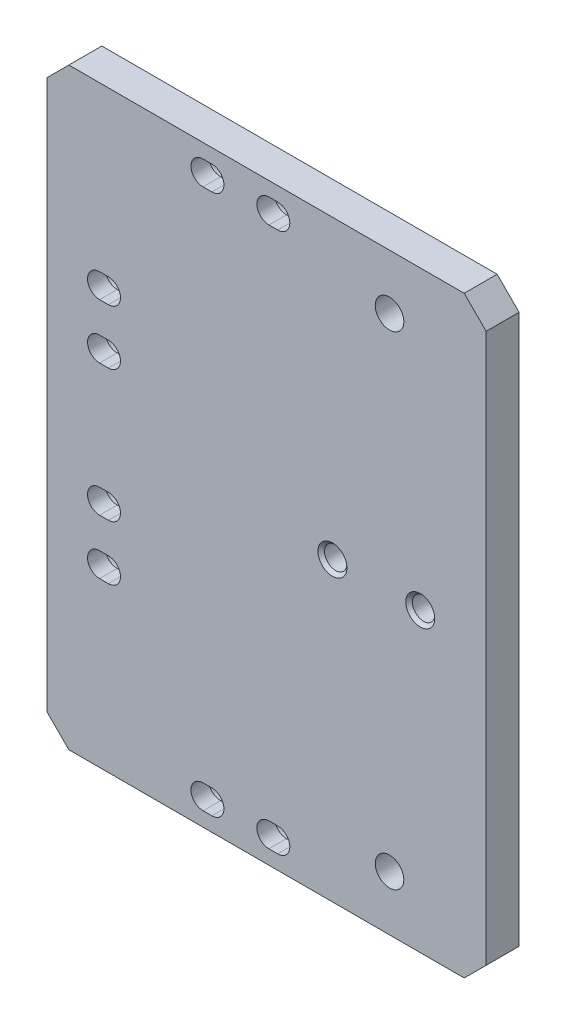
SolidWorks part; units mm, degrees
ref_plane "Plan1" through (0, 0, 0) normal (0, 0, 1) x (1, 0, 0)
ref_plane "Plan2" through (0, 0, 0) normal (0, 1, 0) x (1, 0, 0)
ref_plane "Plan3" through (0, 0, 0) normal (1, 0, 0) x (0, 0, -1)
sketch "Esquisse1" plane through (0, 0, 0) normal (0, 0, 1) x (1, 0, 0)
  line L0 (0, 0) -> (190, 0)
  line L1 (190, 0) -> (200, 10)
  line L2 (200, 260) -> (200, 10)
  line L3 (187.5, 365) -> (187.5, 15) construction
  line L4 (190, 270) -> (0, 270)
  line L5 (0, 270) -> (0, 0)
  line L6 (190, 270) -> (200, 260)
  circle A0 centre (187.5, 365) radius 6.5 construction
  circle A1 centre (187.5, 15) radius 6.5 construction
  dimension "D7" = 13
  dimension "D8" = 13
  dimension "D1" = 270
  dimension "D2" = 200
  dimension "D3" = 10
  dimension "D4" = 10
  dimension "D5" = 10
  dimension "D6" = 10
  dimension "D9" = 15
  dimension "D10" = 350
  dimension "D17" = 187.5
extrude "Base-Extrusion" add sketch "Esquisse1" along normal blind 15
hole_wizard "Chambrage pour vis à tête ronde bombée M21" positions "Esquisse3" profile "Esquisse2" counterbore size "M2" standard "Ansi Métrique"
sketch "Esquisse3" plane through (0, 0, 0) normal (0, 0, -1) x (-1, 0, 0)
  line L0 (0, 270) -> (0, 0) construction
  line L2 (0, 135) -> (-156.8502, 135) construction
  line L3 (-190, 270) -> (0, 270) construction
  point P1 (-26, 165)
  point P3 (-26, 105)
  point P16 (-26, 190)
  point P18 (-26, 80)
  point P19 (-73.1, 258)
  point P21 (-103.1, 258)
  point P27 (-103.1, 12)
  point P28 (-73.1, 12)
  dimension "D1" = 110
  dimension "D2" = 26
  dimension "D3" = 12
  dimension "D4" = 30
  dimension "D5" = 47.1
  dimension "D8" = 60
sketch "Esquisse2" plane through (26, 165, 0) normal (1, 0, 0) x (0, 1, 0)
  line L0 (0, 0) -> (0, 15)
  line L1 (0, 15) -> (5.5, 15)
  line L3 (5.5, 15) -> (5.5, 7)
  line L4 (5.5, 7) -> (8.5, 7)
  line L5 (8.5, 7) -> (8.5, 0)
  line L7 (8.5, 0) -> (0, 0)
  line L11 (0, -6.35) -> (0, 107.95) construction
  dimension "Diamètre du perçage jusqu'au prochain" = 11
  dimension "Profondeur du perçage jusqu'au prochain" = 15
  dimension "Diamètre du chambrage" = 17
  dimension "Profondeur du chambrage" = 7
chamfer "Chanfrein1" distance 10 angle 45 2 edges at (0, 0, 7.5) (0, 270, 7.5)
sketch "Esquisse4" plane through (0, 0, 0) normal (0, 0, -1) x (-1, 0, 0)
  line L0 (0, 135) -> (-233.8599, 135) construction
  line L1 (0, 260) -> (0, 10) construction
  circle A0 centre (-156, 245) radius 6.5
  circle A1 centre (-26, 190) radius 8.5 construction
  circle A2 centre (-156, 25) radius 6.5
  dimension "D1" = 13
  dimension "D2" = 220
  dimension "D3" = 130
extrude "Extrusion1" cut sketch "Esquisse4" against normal through all
hole_wizard "Trou taraudé M121" positions "Esquisse6" profile "Esquisse5" tap size "M12" standard "ISO"
sketch "Esquisse6" plane through (0, 0, 0) normal (0, 0, -1) x (-1, 0, 0)
  line L0 (0, 135) -> (-212.2128, 135) construction
  line L1 (0, 260) -> (0, 10) construction
  line L2 (-200, 10) -> (-200, 260) construction
  point P12 (-170, 135)
  point P14 (-130, 135)
  dimension "D1" = 40
  dimension "D2" = 30
sketch "Esquisse5" plane through (130, 135, 0) normal (1, 0, 0) x (0, 1, 0)
  line L0 (0, 0) -> (0, 15)
  line L1 (0, 15) -> (5.1, 15)
  line L2 (5.1, 15) -> (5.1, 0)
  line L5 (5.1, 0) -> (0, 0)
  line L11 (0, -6.35) -> (0, 107.95) construction
  dimension "Diamètre du trou pour taraudage jusqu'au prochain" = 10.2
  dimension "Profondeur du trou pour taraudage jusqu'au prochain" = 15
chamfer "Chanfrein2" distance 1.5 angle 45 4 edges at (164.9, 135, 0) (164.9, 135, 15) (124.9, 135, 0) (124.9, 135, 15)
sketch "Esquisse7" plane through (0, 0, 0) normal (0, 0, -1) x (-1, 0, 0)
  line L0 (-130, 135) -> (26.2485, 135) construction
  line L1 (-101.1, 263.5) -> (-105.1, 263.5)
  line L2 (-103.1, 263.5) -> (-103.1, 252.5) construction
  line L3 (-101.1, 252.5) -> (-105.1, 252.5)
  line L4 (-105.1, 263.5) -> (-105.1, 252.5) construction
  line L5 (-71.1, 263.5) -> (-75.1, 263.5)
  line L6 (-73.1, 263.5) -> (-73.1, 252.5) construction
  line L7 (-71.1, 252.5) -> (-75.1, 252.5)
  line L8 (-75.1, 263.5) -> (-75.1, 252.5) construction
  line L9 (-71.1, 17.5) -> (-75.1, 17.5)
  line L10 (-71.1, 6.5) -> (-75.1, 6.5)
  line L11 (-73.1, 6.5) -> (-73.1, 17.5) construction
  line L12 (-101.1, 17.5) -> (-105.1, 17.5)
  line L13 (-103.1, 6.5) -> (-103.1, 17.5) construction
  line L14 (-101.1, 6.5) -> (-105.1, 6.5)
  line L15 (-28, 190) -> (-24, 190) construction
  line L16 (-28, 195.5) -> (-24, 195.5)
  line L17 (-28, 184.5) -> (-24, 184.5)
  line L18 (-28, 165) -> (-24, 165) construction
  line L19 (-28, 170.5) -> (-24, 170.5)
  line L20 (-28, 159.5) -> (-24, 159.5)
  line L21 (-28, 105) -> (-24, 105) construction
  line L22 (-28, 110.5) -> (-24, 110.5)
  line L23 (-28, 99.5) -> (-24, 99.5)
  line L24 (-28, 80) -> (-24, 80) construction
  line L25 (-28, 85.5) -> (-24, 85.5)
  line L26 (-28, 74.5) -> (-24, 74.5)
  arc A0 (-101.1, 263.5) -> (-101.1, 252.5) centre (-101.1, 258) cw
  circle A1 centre (-103.1, 258) radius 5.5 construction
  arc A2 (-105.1, 263.5) -> (-105.1, 252.5) centre (-105.1, 258) ccw
  circle A3 centre (-73.1, 258) radius 5.5 construction
  arc A4 (-75.1, 263.5) -> (-75.1, 252.5) centre (-75.1, 258) ccw
  arc A5 (-75.1, 6.5) -> (-75.1, 17.5) centre (-75.1, 12) cw
  arc A6 (-105.1, 6.5) -> (-105.1, 17.5) centre (-105.1, 12) cw
  arc A7 (-71.1, 263.5) -> (-71.1, 252.5) centre (-71.1, 258) cw
  arc A8 (-101.1, 6.5) -> (-101.1, 17.5) centre (-101.1, 12) ccw
  arc A9 (-71.1, 6.5) -> (-71.1, 17.5) centre (-71.1, 12) ccw
  arc A10 (-28, 195.5) -> (-28, 184.5) centre (-28, 190) ccw
  arc A11 (-24, 184.5) -> (-24, 195.5) centre (-24, 190) ccw
  arc A12 (-28, 170.5) -> (-28, 159.5) centre (-28, 165) ccw
  arc A13 (-24, 159.5) -> (-24, 170.5) centre (-24, 165) ccw
  arc A14 (-28, 110.5) -> (-28, 99.5) centre (-28, 105) ccw
  arc A15 (-24, 99.5) -> (-24, 110.5) centre (-24, 105) ccw
  arc A16 (-28, 85.5) -> (-28, 74.5) centre (-28, 80) ccw
  arc A17 (-24, 74.5) -> (-24, 85.5) centre (-24, 80) ccw
  circle A18 centre (-26, 190) radius 5.5 construction
  point P41 (-26, 190)
  point P46 (-26, 165)
  point P55 (-26, 105)
  point P60 (-26, 80)
  dimension "D1" = 2
  dimension "D2" = 4
extrude "Enlèv. mat.-Extru.1" cut sketch "Esquisse7" against normal through all
sketch "Esquisse8" plane through (0, 0, 0) normal (0, 0, -1) x (-1, 0, 0)
  line L0 (-130, 135) -> (-107.3187, 135) construction
  line L1 (-71.1, 266.5) -> (-75.1, 266.5)
  line L2 (-73.1, 266.5) -> (-73.1, 249.5) construction
  line L3 (-71.1, 249.5) -> (-75.1, 249.5)
  line L4 (-75.1, 266.5) -> (-75.1, 249.5) construction
  line L5 (-101.1, 266.5) -> (-105.1, 266.5)
  line L6 (-103.1, 266.5) -> (-103.1, 249.5) construction
  line L7 (-101.1, 249.5) -> (-105.1, 249.5)
  line L8 (-105.1, 266.5) -> (-105.1, 249.5) construction
  line L9 (-71.1, 3.5) -> (-75.1, 3.5)
  line L10 (-73.1, 3.5) -> (-73.1, 20.5) construction
  line L11 (-71.1, 20.5) -> (-75.1, 20.5)
  line L12 (-101.1, 20.5) -> (-105.1, 20.5)
  line L13 (-101.1, 3.5) -> (-105.1, 3.5)
  line L14 (-103.1, 3.5) -> (-103.1, 20.5) construction
  line L15 (-28, 190) -> (-24, 190) construction
  line L16 (-28, 198.5) -> (-24, 198.5)
  line L17 (-28, 181.5) -> (-24, 181.5)
  line L18 (-28, 165) -> (-24, 165) construction
  line L19 (-28, 173.5) -> (-24, 173.5)
  line L20 (-28, 156.5) -> (-24, 156.5)
  line L21 (-28, 105) -> (-24, 105) construction
  line L22 (-28, 113.5) -> (-24, 113.5)
  line L23 (-28, 96.5) -> (-24, 96.5)
  line L24 (-28, 80) -> (-24, 80) construction
  line L25 (-28, 88.5) -> (-24, 88.5)
  line L26 (-28, 71.5) -> (-24, 71.5)
  circle A0 centre (-73.1, 258) radius 8.5 construction
  circle A1 centre (-73.1, 258) radius 8.5 construction
  arc A2 (-75.1, 266.5) -> (-75.1, 249.5) centre (-75.1, 258) ccw
  arc A3 (-75.1, 263.5) -> (-75.1, 252.5) centre (-75.1, 258) ccw construction
  circle A4 centre (-103.1, 258) radius 8.5 construction
  circle A5 centre (-103.1, 258) radius 8.5 construction
  arc A6 (-105.1, 266.5) -> (-105.1, 249.5) centre (-105.1, 258) ccw
  arc A7 (-105.1, 263.5) -> (-105.1, 252.5) centre (-105.1, 258) ccw construction
  arc A8 (-75.1, 3.5) -> (-75.1, 20.5) centre (-75.1, 12) cw
  arc A9 (-105.1, 3.5) -> (-105.1, 20.5) centre (-105.1, 12) cw
  arc A10 (-101.1, 266.5) -> (-101.1, 249.5) centre (-101.1, 258) cw
  arc A11 (-71.1, 266.5) -> (-71.1, 249.5) centre (-71.1, 258) cw
  arc A12 (-101.1, 3.5) -> (-101.1, 20.5) centre (-101.1, 12) ccw
  arc A13 (-71.1, 3.5) -> (-71.1, 20.5) centre (-71.1, 12) ccw
  arc A14 (-28, 198.5) -> (-28, 181.5) centre (-28, 190) ccw
  arc A15 (-24, 181.5) -> (-24, 198.5) centre (-24, 190) ccw
  arc A16 (-28, 173.5) -> (-28, 156.5) centre (-28, 165) ccw
  arc A17 (-24, 156.5) -> (-24, 173.5) centre (-24, 165) ccw
  arc A18 (-28, 113.5) -> (-28, 96.5) centre (-28, 105) ccw
  arc A19 (-24, 96.5) -> (-24, 113.5) centre (-24, 105) ccw
  arc A20 (-28, 88.5) -> (-28, 71.5) centre (-28, 80) ccw
  arc A21 (-24, 71.5) -> (-24, 88.5) centre (-24, 80) ccw
  circle A22 centre (-26, 190) radius 8.5 construction
  point P52 (-26, 190)
  point P57 (-26, 165)
  point P64 (-26, 105)
  point P71 (-26, 80)
  dimension "D1" = 4
extrude "Enlèv. mat.-Extru.2" cut sketch "Esquisse8" against normal up to surface (7 mm away)
